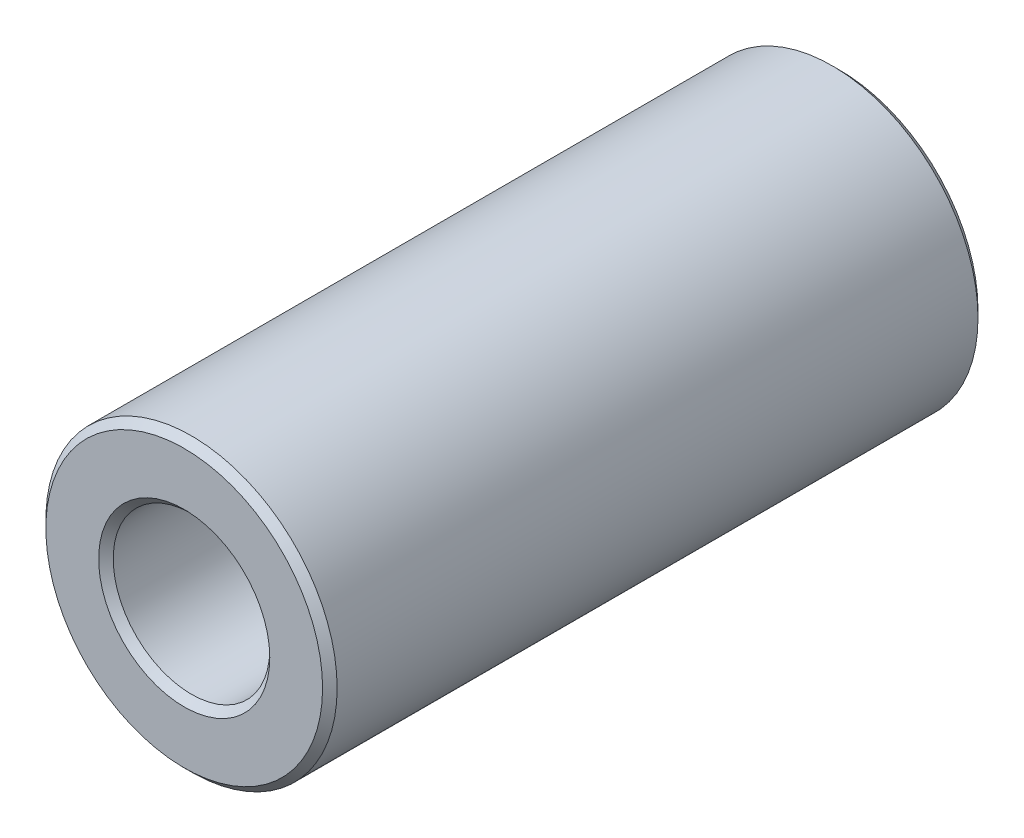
SolidWorks part; units mm, degrees
ref_plane "Front Plane" through (0, 0, 0) normal (0, 0, 1) x (1, 0, 0)
ref_plane "Top Plane" through (0, 0, 0) normal (0, 1, 0) x (1, 0, 0)
ref_plane "Right Plane" through (0, 0, 0) normal (1, 0, 0) x (0, 0, -1)
sketch "Sketch1" plane through (0, 0, 0) normal (0, 0, 1) x (1, 0, 0)
  circle A0 centre (0, 0) radius 4
  circle A1 centre (0, 0) radius 2.15
  dimension "D1" = 8
  dimension "D2" = 4.3
extrude "Boss-Extrude2" add sketch "Sketch1" along normal mid plane 18
chamfer "Chamfer3" distance 0.2 angle 45 4 edges at (4, 0, 9) (4, 0, -9) (2.15, 0, -9) (2.15, 0, 9)
